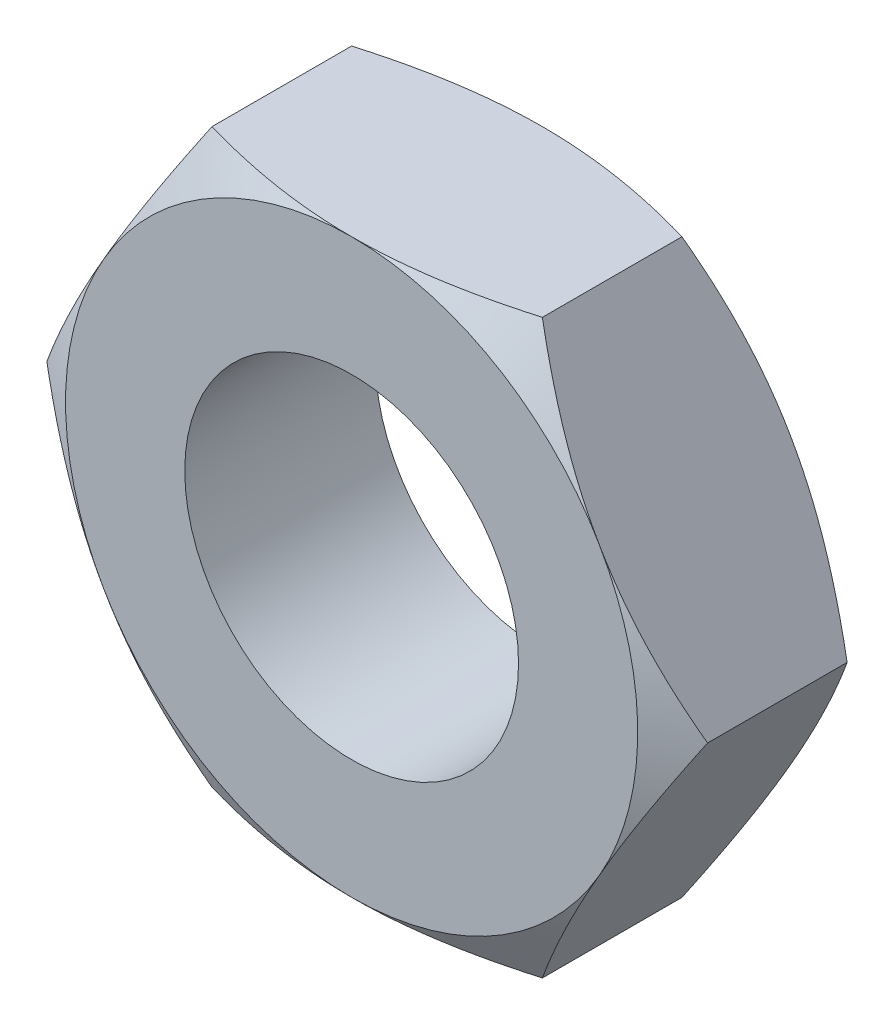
SolidWorks part; units mm, degrees
ref_plane "Front Plane" through (0, 0, 0) normal (0, 0, 1) x (1, 0, 0)
ref_plane "Top Plane" through (0, 0, 0) normal (0, 1, 0) x (1, 0, 0)
ref_plane "Right Plane" through (0, 0, 0) normal (1, 0, 0) x (0, 0, -1)
sketch "Sketch1" plane through (0, 0, 0) normal (0, 0, 1) x (1, 0, 0)
  line L1 (8.6603, -15) -> (17.3205, 0)
  line L2 (17.3205, 0) -> (8.6603, 15)
  line L3 (8.6603, 15) -> (-8.6603, 15)
  line L4 (-8.6603, 15) -> (-17.3205, 0)
  line L5 (-17.3205, 0) -> (-8.6603, -15)
  line L6 (-8.6603, -15) -> (8.6603, -15)
  circle A0 centre (0, 0) radius 15 construction
  dimension "D1" = 30
extrude "Extrude1" add sketch "Sketch1" along normal blind 10
hole_wizard " Tapped Hole1" positions "Sketch3" profile "Sketch2" tap size "M20" standard "DIN"
sketch "Sketch3" plane through (0, 0, 10) normal (0, 0, 1) x (1, 0, 0)
  point P0 (0, 0)
sketch "Sketch2" plane through (0, 0, 10) normal (1, 0, 0) x (0, -1, 0)
  line L0 (0, 0) -> (0, 10)
  line L1 (0, 10) -> (8.75, 10)
  line L2 (8.75, 10) -> (8.75, 0)
  line L5 (8.75, 0) -> (0, 0)
  line L11 (0, -6.35) -> (0, 107.95) construction
  dimension "Thru Tap Drill Dia." = 17.5
  dimension "Thru Tap Drill Depth" = 10
sketch "Sketch4" plane through (0, 0, 0) normal (0, 1, 0) x (1, 0, 0)
  line L0 (-17.3205, -8.6603) -> (-15, -10)
  line L1 (-17.3205, -10) -> (-17.3205, 0) construction
  line L2 (-8.6603, -10) -> (-17.3205, -10) construction
  line L3 (-17.3205, -10) -> (-17.3205, -8.6603)
  line L4 (-15, -10) -> (-17.3205, -10)
  line L5 (-17.3205, -5) -> (17.3205, -5) construction
  line L6 (17.3205, -10) -> (17.3205, 0) construction
  line L7 (-17.3205, -1.3397) -> (-15, 0)
  line L8 (-17.3205, 0) -> (-17.3205, -1.3397)
  line L9 (-15, 0) -> (-17.3205, 0)
  line L10 (0, 0) -> (0, -10) construction
  line L11 (8.6603, -10) -> (-8.6603, -10) construction
  dimension "D1" = 30
  dimension "D2" = 15
revolve "Cut-Revolve1" cut sketch "Sketch4" angle 360 about L10
